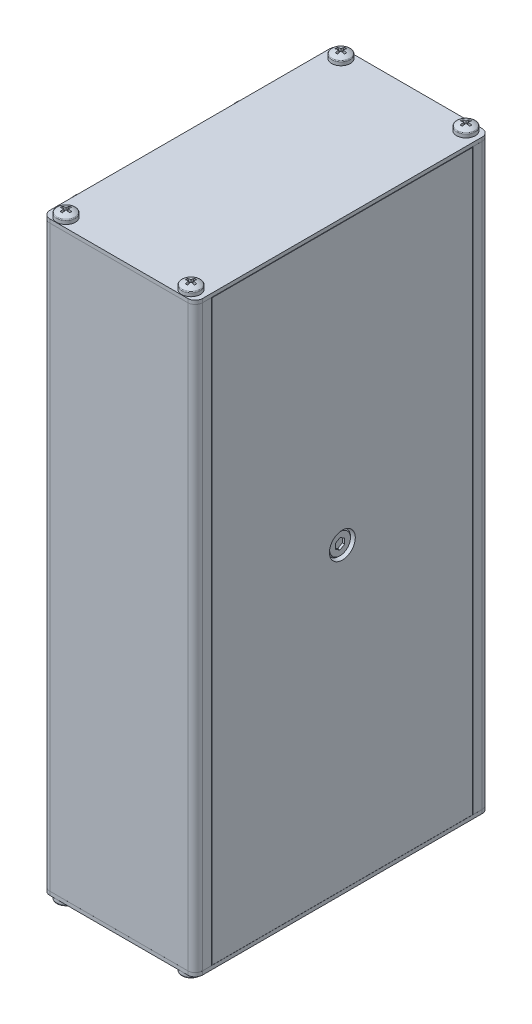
SolidWorks part; units mm, degrees
ref_plane "Front Plane" through (0, 0, 0) normal (0, 0, 1) x (1, 0, 0)
ref_plane "Top Plane" through (0, 0, 0) normal (0, 1, 0) x (1, 0, 0)
ref_plane "Right Plane" through (0, 0, 0) normal (1, 0, 0) x (0, 0, -1)
imported_body "Imported1"
imported_body "Imported2"
imported_body "Imported3"
sketch "Sketch1" plane through (50.8, 0, 0) normal (-1, 0, 0) x (0, 0, 1)
  line L1 (-995.68, 81.6864) -> (63.5, 81.6864)
  line L2 (-995.68, 81.6864) -> (-995.68, -52.9209)
  line L3 (-995.68, -52.9209) -> (63.5, -52.9209)
  line L4 (63.5, 81.6864) -> (63.5, -52.9209)
  line L6 (63.5, 198.3207) -> (63.5, -51.3334) construction
  line L7 (60.3308, -52.9209) -> (63.5058, -52.9209) construction
  line L8 (-995.68, 62.7634) -> (-995.68, -38.8366) construction
  line L9 (39.243, 68.9864) -> (-39.243, 68.9864) construction
  dimension "D1" = 12.7
extrude "Cut-Extrude1" cut sketch "Sketch1" along normal blind 2.54
